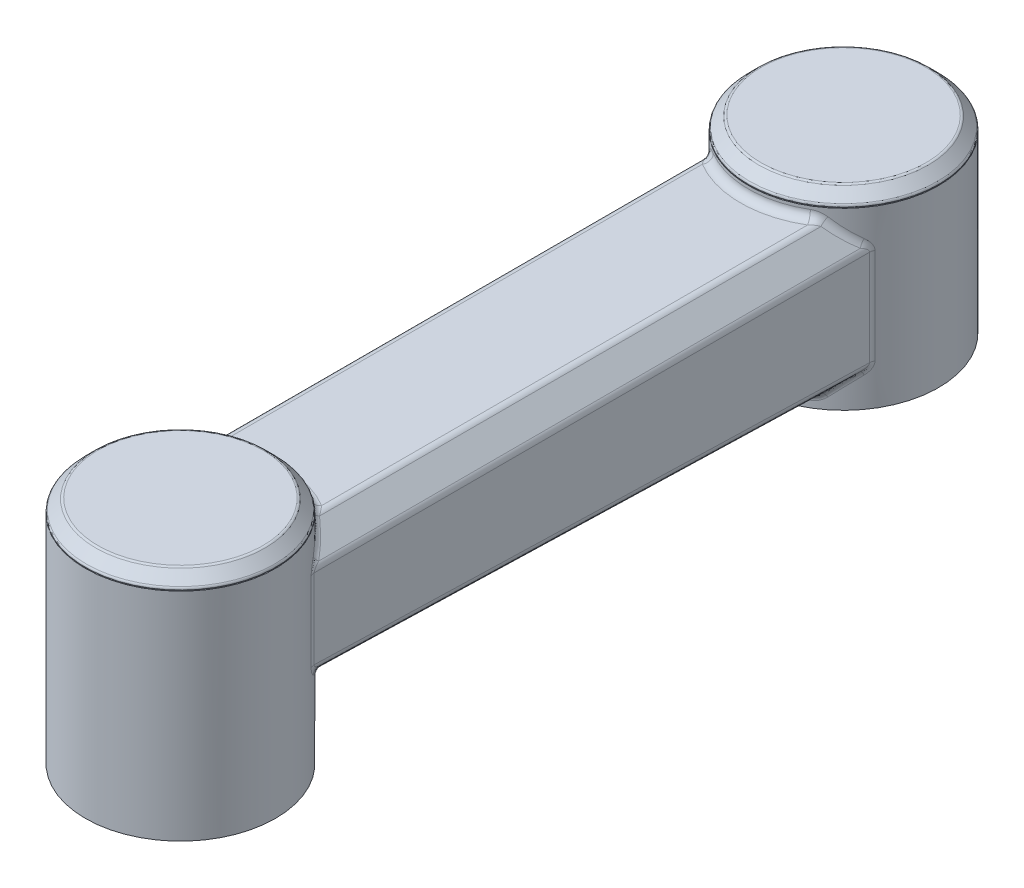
SolidWorks part; units mm, degrees
ref_plane "Ön Düzlem" through (0, 0, 0) normal (0, 0, 1) x (1, 0, 0)
ref_plane "Üst Düzlem" through (0, 0, 0) normal (0, 1, 0) x (1, 0, 0)
ref_plane "Sağ Düzlem" through (0, 0, 0) normal (1, 0, 0) x (0, 0, -1)
sketch "Çizim1" plane through (0, 0, 0) normal (1, 0, 0) x (0, 0, -1)
  line L1 (0, 0) -> (-59.5, 0)
  line L2 (0, 0) -> (0, 110)
  line L3 (0, 110) -> (-59.5, 110)
  line L4 (-59.5, 0) -> (-59.5, 110)
  line L5 (0, 0) -> (-45, 0)
  dimension "D1" = 59.5
  dimension "D2" = 110
revolve "Döndür1" add sketch "Çizim1" angle 360 about L2
sketch "Çizim2" plane through (0, 110, 0) normal (0, 1, 0) x (1, 0, 0)
  circle A0 centre (0, 0) radius 59.5
extrude "Yükseklik-Ekstrüzyon1" add sketch "Çizim2" along normal blind 8 separate body
chamfer "Pah1" distance 0.5 angle 45 1 edges at (0, 110, -59.5)
chamfer "Pah2" distance 7 angle 45 1 edges at (0, 118, 59.5)
fillet "Radyus1" radius 2 2 edges at (0, 111, 59.5) (0, 118, 52.5)
sketch "Çizim3" plane through (0, 0, 0) normal (0, 0, 1) x (1, 0, 0)
  line L0 (0, 110.1716) -> (0, 0) construction
  line L1 (-59.5, 110.1716) -> (59.5, 110.1716) construction
  line L3 (50, 7.5858) -> (-50, 7.5858)
  line L4 (50, 7.5858) -> (50, 102.5858)
  line L5 (50, 102.5858) -> (-50, 102.5858)
  line L6 (-50, 7.5858) -> (-50, 102.5858)
  line L7 (50, 7.5858) -> (-50, 102.5858) construction
  line L8 (50, 102.5858) -> (-50, 7.5858) construction
  point P5 (0, 55.0858)
  dimension "D1" = 95
  dimension "D2" = 100
ref_plane "Düzlem1" through (0, 0, 400) normal (0, 0, 1) x (1, 0, 0)
sketch "Çizim4" plane through (0, 0, 400) normal (0, 0, 1) x (1, 0, 0)
  line L0 (50, 7.5858) -> (-50, 102.5858) construction
  line L2 (50, 19.1687) -> (50, 102.5858)
  line L3 (50, 102.5858) -> (-50, 102.5858)
  line L4 (-50, 19.1687) -> (-50, 102.5858)
  line L5 (37.8075, 19.1687) -> (-50, 102.5858) construction
  line L6 (50, 102.5858) -> (-37.8075, 19.1687) construction
  line L7 (-50, 19.1687) -> (50, 19.1687)
  point P0 (0, 55.0858)
  dimension "D1" = 100
loft "Loft1" add profiles "Çizim4", "Çizim3"
ref_plane "Düzlem2" through (0, 0, 207.5) normal (0, 0, 1) x (1, 0, 0)
mirror "Aynalama1" about plane through (0, 0, 207.5) normal (0, 0, 1) of "Pah2", "Yükseklik-Ekstrüzyon1", "Döndür1", "Pah1", "Radyus1"
mirror "Aynalama3" about plane through (0, 0, 207.5) normal (0, 0, 1)
chamfer "Pah3" distance 15 angle 45 4 edges
fillet "Radyus2" radius 5 24 edges at (43.2339, 26.6566, 374.1211) (43.2339, 17.0069, 40.8789) (43.2339, 94.3519, 40.8789) (43.2339, 94.3519, 374.1211) (50, 87.5858, 207.5) (50, 55.5559, 32.2529) (50, 28.6007, 207.5) (50, 60.6306, 382.7471) (0, 17.8801, 355.5) (35, 13.5944, 207.5) (0, 9.3087, 59.5) (-35, 13.5944, 207.5) (-43.2339, 17.0069, 40.8789) (-43.2339, 26.6566, 374.1211) (-50, 28.6007, 207.5) (-50, 55.5559, 32.2529) (-50, 60.6306, 382.7471) (-50, 87.5858, 207.5) (-43.2339, 94.3519, 40.8789) (-43.2339, 94.3519, 374.1211) (-35, 102.5858, 207.5) (0, 102.5858, 59.5) (35, 102.5858, 207.5) (0, 102.5858, 355.5)
sketch "Çizim5" plane through (50, 0, 0) normal (1, 0, 0) x (0, 0, -1)
  line L1 (-93.7035, 30.4793) -> (-180.3135, 30.4793)
  line L2 (-93.7035, 30.4793) -> (-93.7035, 67.048)
  line L3 (-93.7035, 67.048) -> (-180.3135, 67.048)
  line L4 (-180.3135, 30.4793) -> (-180.3135, 67.048)
  line L5 (-93.7035, 30.4793) -> (-180.3135, 67.048) construction
  line L6 (-93.7035, 67.048) -> (-180.3135, 30.4793) construction
  point P0 (-137.0085, 48.7637)
sketch "Çizim7" plane through (0, 0, 0) normal (0, -1, 0) x (1, 0, 0)
  circle A0 centre (0, 415) radius 45
sketch "Çizim8" plane through (0, 0, 0) normal (0, -1, 0) x (1, 0, 0)
  circle A0 centre (0, 0) radius 45
extrude "Yükseklik-Ekstrüzyon2" add sketch "Çizim7" along normal blind 7 contours A0
extrude "Yükseklik-Ekstrüzyon3" add sketch "Çizim8" along normal blind 7 contours A0
sketch "Çizim9" plane through (0, 0, 0) normal (0, -1, 0) x (1, 0, 0)
  circle A0 centre (0, 415) radius 59.5
extrude "Yükseklik-Ekstrüzyon4" add sketch "Çizim9" along normal blind 26
sketch "Çizim10" plane through (0, -26, 0) normal (0, -1, 0) x (1, 0, 0)
  circle A0 centre (0, 415) radius 45
extrude "Kes-Ekstrüzyon1" cut sketch "Çizim10" against normal blind 5
